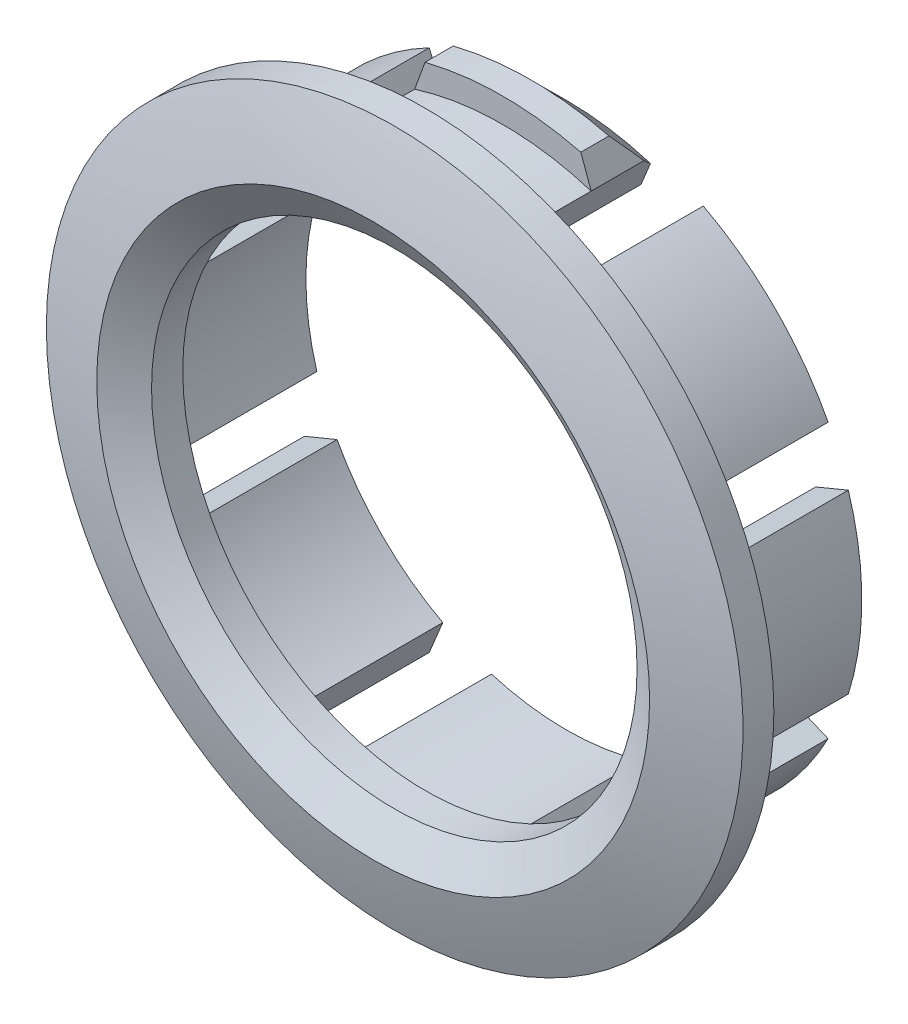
SolidWorks part; units mm, degrees
ref_plane "Plan de face" through (0, 0, 0) normal (0, 0, 1) x (1, 0, 0)
ref_plane "Plan de dessus" through (0, 0, 0) normal (0, 1, 0) x (1, 0, 0)
ref_plane "Plan de droite" through (0, 0, 0) normal (1, 0, 0) x (0, 0, -1)
sketch "Esquisse1" plane through (0, 0, 0) normal (0, 0, 1) x (1, 0, 0)
  circle A2 centre (0, 0) radius 9.9
  circle A3 centre (0, 0) radius 9.9
  dimension "D1" = 0.1
extrude "Extrusion1" add sketch "Esquisse1" along normal up to surface (0.8767 mm away)
sketch "Esquisse2" plane through (0, 0, 0) normal (0, 0, -1) x (-1, 0, 0)
  circle A2 centre (0, 0) radius 8.4
  circle A3 centre (0, 0) radius 8.4
  dimension "D1" = 0.1
extrude "Extrusion2" add sketch "Esquisse2" along normal offset from surface (4 mm away) 1.5
sketch "Esquisse3" plane through (0, 0, -4) normal (0, 0, -1) x (-1, 0, 0)
  circle A0 centre (0, 0) radius 6.9
  dimension "D1" = 13.8
extrude "Enlèv. mat.-Extru.1" cut sketch "Esquisse3" against normal up to next
chamfer "Chanfrein1" distance 1 angle 45 1 edges at (-6.9, 0, 1.7223)
sketch "Esquisse5" plane through (0, 0, -4) normal (0, 0, -1) x (-1, 0, 0)
  circle A2 centre (0, 0) radius 7.4
  circle A3 centre (0, 0) radius 7.4
  dimension "D1" = 0.5
extrude "Enlèv. mat.-Extru.3" cut sketch "Esquisse5" against normal up to surface (4 mm away)
sketch "Esquisse4" plane through (0, 0, -4) normal (0, 0, -1) x (-1, 0, 0)
  line L0 (0, 0) -> (0, 11.2307) construction
  line L1 (0, 0) -> (4.5076, 10.8824) construction
  line L2 (1.932, 6.624) -> (2.5088, 8.0166)
  line L3 (3.3178, 6.05) -> (3.8946, 7.4426)
  circle A0 centre (0, 0) radius 6.9 construction
  arc A1 (3.3178, 6.05) -> (1.932, 6.624) centre (0, 0) ccw
  circle A2 centre (0, 0) radius 8.4 construction
  arc A3 (3.8946, 7.4426) -> (2.5088, 8.0166) centre (0, 0) ccw
  dimension "D1" = 22.5
  dimension "D2" = 1.5
extrude "Enlèv. mat.-Extru.2" cut sketch "Esquisse4" against normal up to surface (4 mm away)
pattern_circular "Répétition circulaire1" count 8 over 360 about axis through (0, 0, 0) along (0, 0, 1) of "Enlèv. mat.-Extru.2"
sketch "Esquisse6" plane through (0, 0, -4) normal (0, 0, -1) x (-1, 0, 0)
  line L0 (0, 0) -> (0, 11.8706) construction
  line L1 (-2.5088, 8.0166) -> (-2.214, 8.8266)
  line L2 (2.5088, 8.0166) -> (2.214, 8.8266)
  arc A0 (2.5088, 8.0166) -> (-2.5088, 8.0166) centre (0, 0) ccw construction
  arc A1 (2.5088, 8.0166) -> (-2.5088, 8.0166) centre (0, 0) ccw
  arc A2 (2.214, 8.8266) -> (-2.214, 8.8266) centre (0, 0) ccw
  arc A3 (2.7179, 8.6847) -> (-2.7179, 8.6847) centre (0, 0) ccw construction
  dimension "D2" = 40
  dimension "D1" = 0.7
extrude "Extrusion3" add sketch "Esquisse6" against normal offset from surface (1.8 mm away) 0.2
chamfer "Chanfrein2" distance 1 angle 45 1 edges at (0, 9.1, -4)
mirror "Symétrie1" about plane through (0, 0, 0) normal (0, 1, 0) of "Chanfrein2", "Extrusion3"
